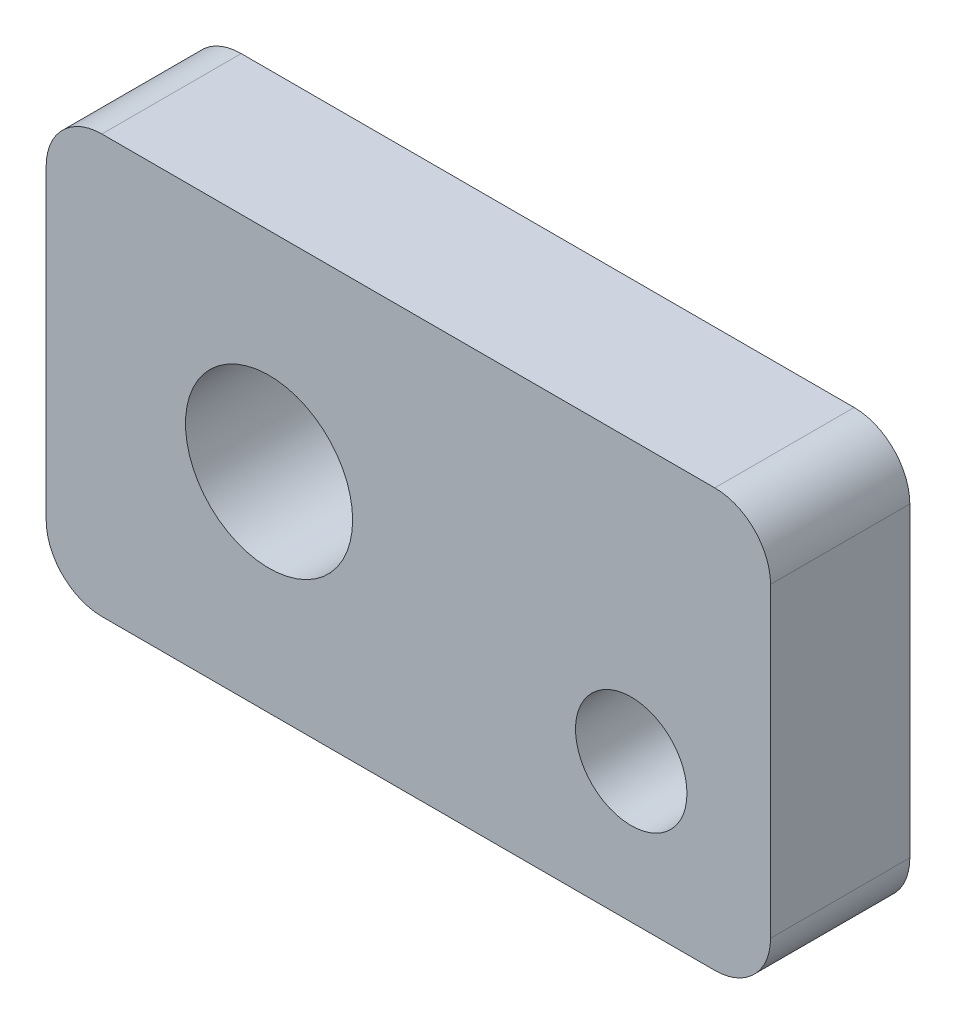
SolidWorks part; units mm, degrees
ref_plane "Plan de face" through (0, 0, 0) normal (0, 0, 1) x (1, 0, 0)
ref_plane "Plan de dessus" through (0, 0, 0) normal (0, 1, 0) x (1, 0, 0)
ref_plane "Plan de droite" through (0, 0, 0) normal (1, 0, 0) x (0, 0, -1)
sketch "Esquisse1" plane through (0, 0, 0) normal (0, 0, 1) x (1, 0, 0)
  line L0 (13, 0) -> (-2, 0) construction
  line L1 (-13, 7.5) -> (13, 7.5)
  line L2 (-13, 7.5) -> (-13, -7.5)
  line L3 (-13, -7.5) -> (13, -7.5)
  line L4 (13, 7.5) -> (13, -7.5)
  line L5 (-13, 7.5) -> (13, -7.5) construction
  line L6 (-13, -7.5) -> (13, 7.5) construction
  line L7 (-8, 0) -> (-13, 0) construction
  line L8 (8, -4.5) -> (8, -7.5) construction
  circle A0 centre (-5, 0) radius 3
  circle A1 centre (8, -2.5) radius 2
  point P0 (-5, 0)
  point P12 (0, 0)
  dimension "D3" = 6
  dimension "D5" = 4
  dimension "D1" = 5
  dimension "D2" = 15
  dimension "D4" = 15
  dimension "D6" = 3
  dimension "D7" = 5
extrude "Boss.-Extru.1" add sketch "Esquisse1" along normal blind 5
fillet "Congé1" radius 2 4 edges at (-13, -7.5, 2.5) (13, -7.5, 2.5) (13, 7.5, 2.5) (-13, 7.5, 2.5)
